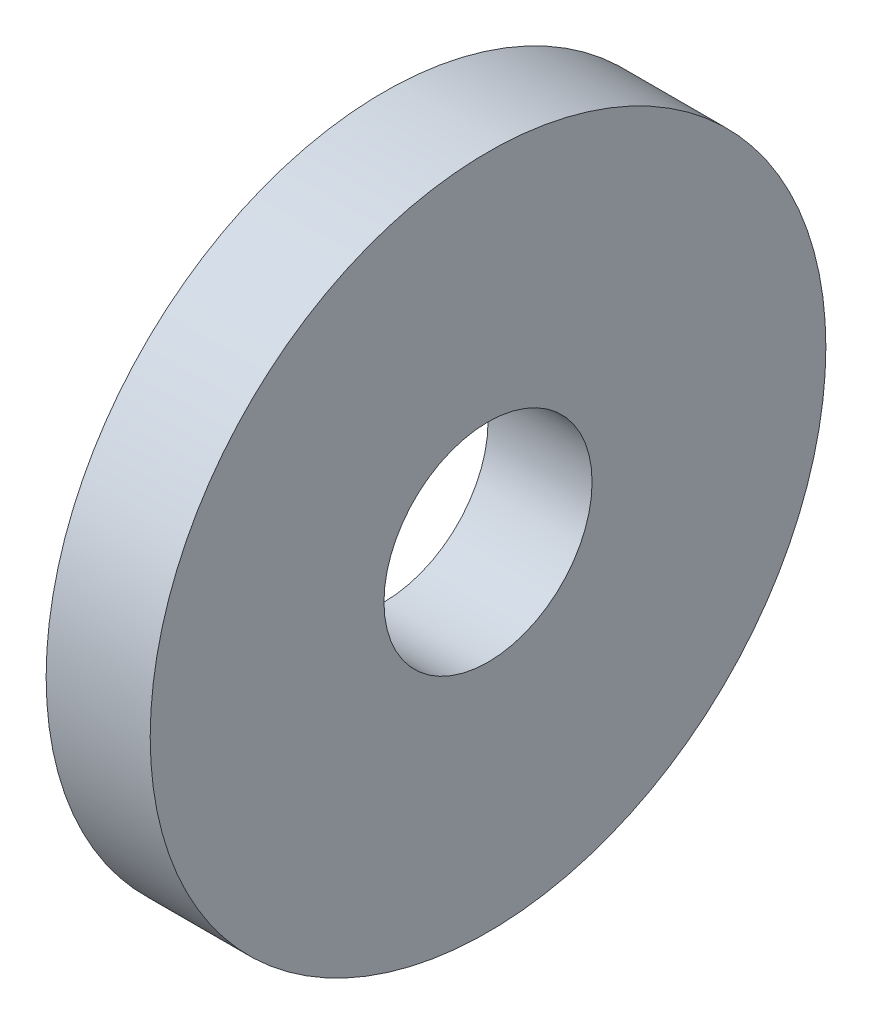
SolidWorks part; units mm, degrees
ref_plane "Plano frontal" through (0, 0, 0) normal (0, 0, 1) x (1, 0, 0)
ref_plane "Plano superior" through (0, 0, 0) normal (0, 1, 0) x (1, 0, 0)
ref_plane "Plano direito" through (0, 0, 0) normal (1, 0, 0) x (0, 0, -1)
sketch "Esboço1" plane through (0, 0, 0) normal (1, 0, 0) x (0, 0, -1)
  circle A0 centre (0, 0) radius 9.74
  circle A1 centre (0, 0) radius 3
  dimension "D1" = 19.48
  dimension "D2" = 6
extrude "Ressalto-extrusão1" add sketch "Esboço1" along normal blind 3
sketch "Esboço2" [suppressed] plane through (0, 0, 0) normal (-1, 0, 0) x (0, 0, 1)
  circle A0 centre (0, 0) radius 3.545
  dimension "D1" = 7
extrude "Ressalto-extrusão2" [suppressed] add sketch "Esboço2" along normal blind 3.26 contours A0 M3
